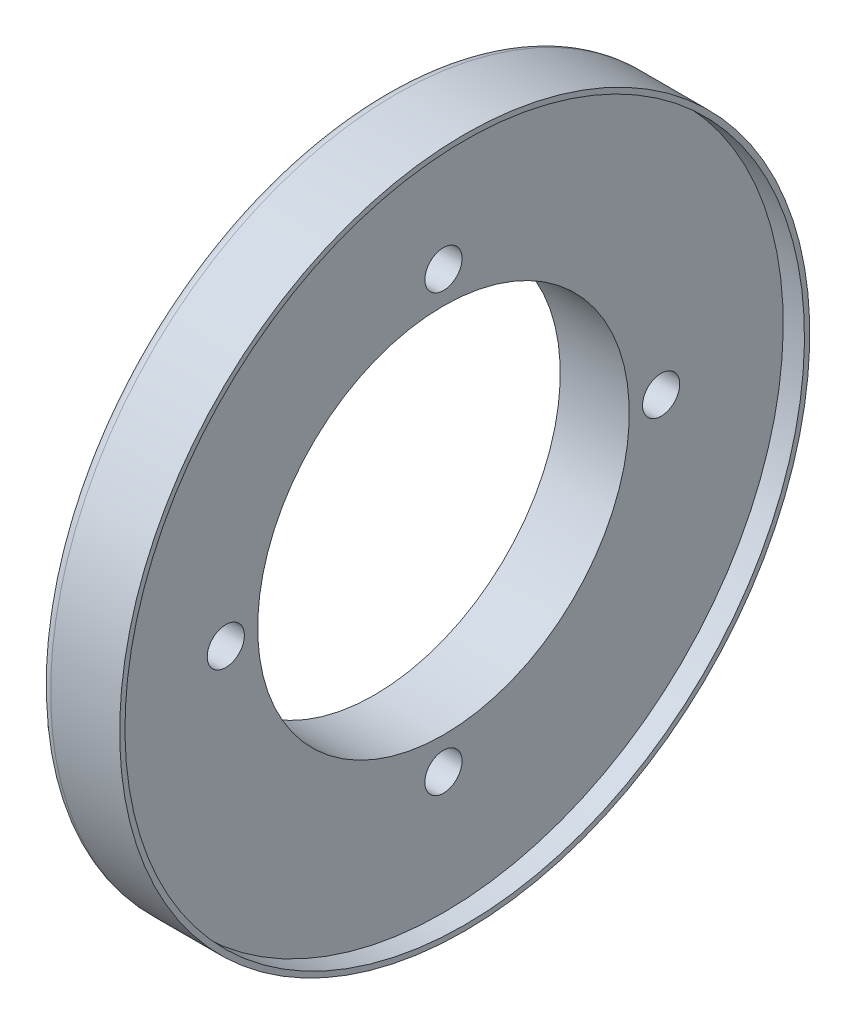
SolidWorks part; units mm, degrees
ref_plane "Vorderansicht" through (0, 0, 0) normal (0, 0, 1) x (1, 0, 0)
ref_plane "Draufsicht" through (0, 0, 0) normal (0, 1, 0) x (1, 0, 0)
ref_plane "Seitenansicht" through (0, 0, 0) normal (1, 0, 0) x (0, 0, -1)
sketch "Skizze1" plane through (0, 0, 0) normal (0, 0, 1) x (1, 0, 0)
  line L0 (-23.9525, 0) -> (13, 0) construction
  line L1 (0, 35) -> (0, 47)
  line L2 (0, 47) -> (2, 47)
  line L3 (2, 47) -> (2, 63)
  line L4 (4, 65) -> (17, 65)
  line L5 (17, 65) -> (17, 64)
  line L6 (0, 35) -> (13, 35)
  line L7 (17, 64) -> (13, 64)
  line L8 (13, 64) -> (13, 35)
  line L9 (17, 0) -> (135.8233, 0) construction
  arc A0 (2, 63) -> (4, 65) centre (4, 63) cw
  dimension "D5" = 2
  dimension "D1" = 94
  dimension "D2" = 130
  dimension "D3" = 17
  dimension "D4" = 2
  dimension "D6" = 4
  dimension "D7" = 128
  dimension "D8" = 70
revolve "Rotation1" add sketch "Skizze1" angle 360 about L0
sketch "Skizze2" plane through (13, 0, 0) normal (1, 0, 0) x (0, 0, -1)
  line L0 (41, 0) -> (-41, 0) construction
  line L1 (0, 41) -> (0, -41) construction
  circle A0 centre (41, 0) radius 3.5
  circle A1 centre (0, 0) radius 41 construction
  circle A2 centre (0, -41) radius 3.5
  circle A3 centre (-41, 0) radius 3.5
  circle A4 centre (0, 41) radius 3.5
  point P5 (0, 0)
  dimension "D1" = 7
  dimension "D2" = 82
extrude "Schnitt-Linear austragen1" cut sketch "Skizze2" against normal through all
